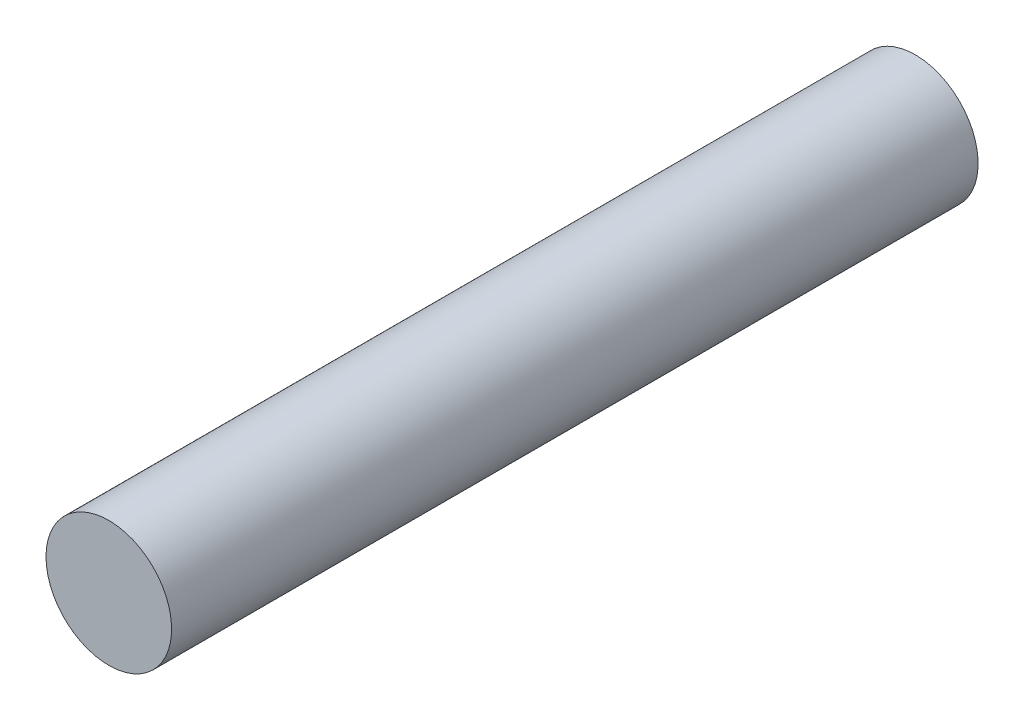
SolidWorks part; units mm, degrees
ref_plane "Plan de face" through (0, 0, 0) normal (0, 0, 1) x (1, 0, 0)
ref_plane "Plan de dessus" through (0, 0, 0) normal (0, 1, 0) x (1, 0, 0)
ref_plane "Plan de droite" through (0, 0, 0) normal (1, 0, 0) x (0, 0, -1)
sketch "Esquisse1" plane through (0, 0, 0) normal (0, 0, 1) x (1, 0, 0)
  circle A0 centre (0, 0) radius 9.5
extrude "Extrusion1" add sketch "Esquisse1" along normal blind 122
